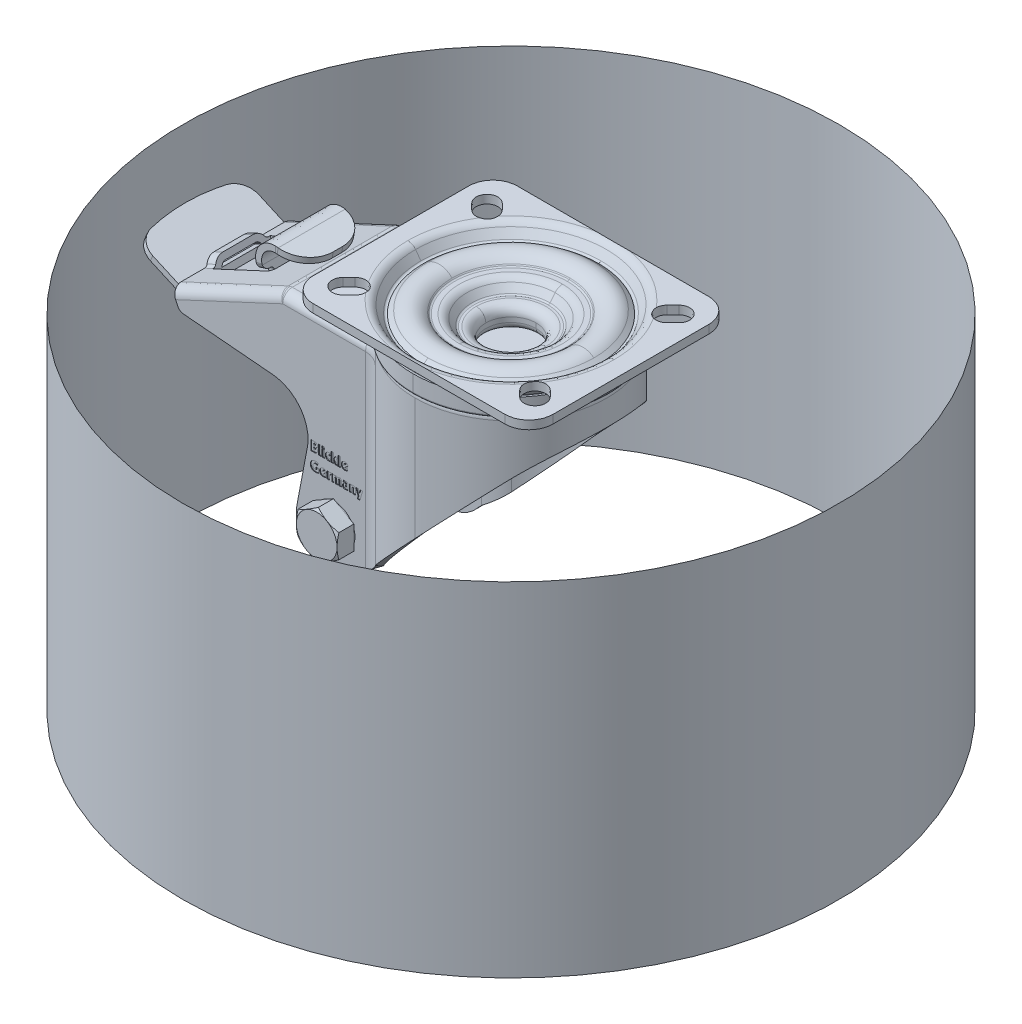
SolidWorks part; units mm, degrees
ref_plane "Ebene vorne" through (0, 0, 0) normal (0, 0, 1) x (1, 0, 0)
ref_plane "Ebene oben" through (0, 0, 0) normal (0, 1, 0) x (1, 0, 0)
ref_plane "Ebene rechts" through (0, 0, 0) normal (1, 0, 0) x (0, 0, -1)
imported_body "Importiert1"
sketch "Skizze1" plane through (0, 0, 0) normal (0, 1, 0) x (1, 0, 0)
  circle A0 centre (0, 0) radius 136.8135
  spline S0 degree 3 poles (-135.3982, 15.6667) (-135.7752, 13.6007) (-136.3779, 9.4507) (-136.8327, 3.1456) (-136.8321, -3.1597) (-136.3773, -9.4545) (-135.7749, -13.6019) (-135.3982, -15.6667) knots 0 0 0 0 0.2 0.4 0.6 0.8 1 1 1 1 construction
surface "Oberfläche-Linear austragen1" sketch "Skizze1" parameters "D1"=143
